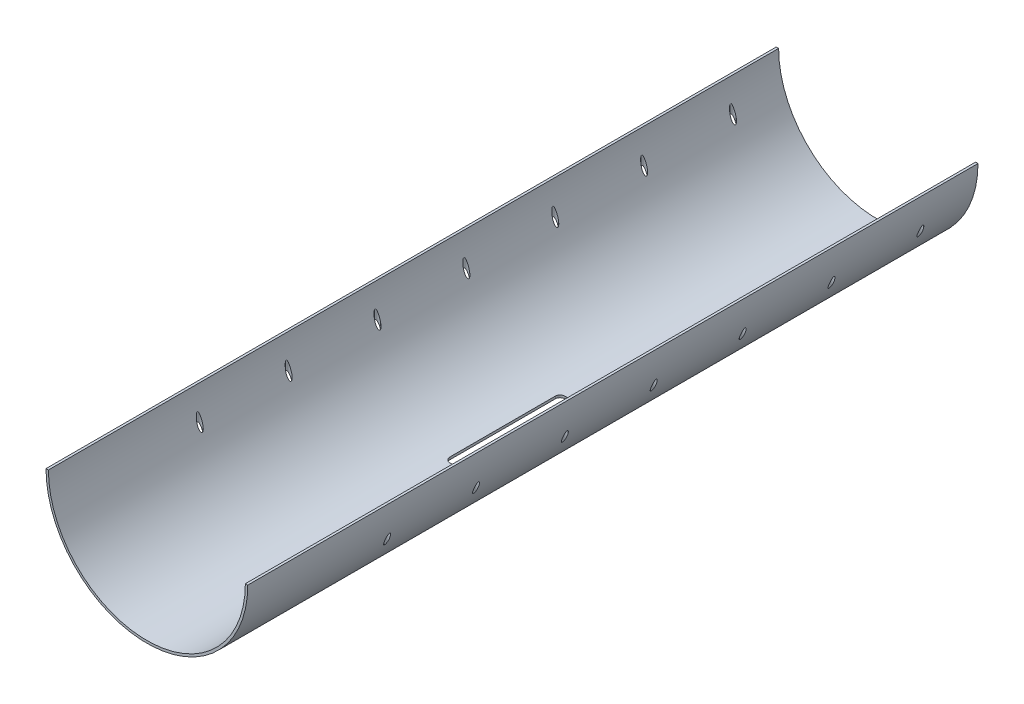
SolidWorks part; units mm, degrees
ref_plane "Plane1" through (0, 0, 0) normal (0, 0, 1) x (1, 0, 0)
ref_plane "Plane2" through (0, 0, 0) normal (0, 1, 0) x (1, 0, 0)
ref_plane "Plane3" through (0, 0, 0) normal (1, 0, 0) x (0, 0, -1)
sketch "Sketch1" plane through (0, 0, 0) normal (0, 0, 1) x (1, 0, 0)
  line L0 (-266.7, 0) -> (-260.35, 0)
  line L1 (260.35, 0) -> (266.7, 0)
  arc A0 (-260.35, 0) -> (260.35, 0) centre (0, 0) ccw
  arc A1 (-266.7, 0) -> (266.7, 0) centre (0, 0) ccw
  dimension "D1" = 520.7
  dimension "D2" = 533.4
extrude "Base-Extrude" add sketch "Sketch1" along normal blind 1930.4
sketch "Sketch2" plane through (0, 0, 0) normal (0, 1, 0) x (1, 0, 0)
  line L0 (0, 138.1703) -> (0, -2023.3965) construction
  line L2 (-6.35, -1123.2467) -> (6.35, -1123.2467)
  line L3 (-19.05, -1110.5467) -> (-19.05, -831.1467)
  line L4 (-6.35, -818.4467) -> (6.35, -818.4467)
  line L5 (19.05, -1110.5467) -> (19.05, -831.1467)
  line L6 (-19.05, -1123.2467) -> (19.05, -818.4467) construction
  line L7 (-19.05, -818.4467) -> (19.05, -1123.2467) construction
  arc A0 (6.35, -818.4467) -> (19.05, -831.1467) centre (6.35, -831.1467) cw
  arc A1 (-19.05, -831.1467) -> (-6.35, -818.4467) centre (-6.35, -831.1467) cw
  arc A2 (6.35, -1123.2467) -> (19.05, -1110.5467) centre (6.35, -1110.5467) ccw
  arc A3 (-6.35, -1123.2467) -> (-19.05, -1110.5467) centre (-6.35, -1110.5467) cw
  point P3 (0, -970.8467)
  dimension "D3" = 12.7
  dimension "D1" = 38.1
  dimension "D2" = 304.8
extrude "Cut-Extrude1" cut sketch "Sketch2" against normal through all
sketch "Sketch3" plane through (0, 0, 0) normal (0, 1, 0) x (1, 0, 0)
  circle A23 centre (-247.5629, -133.35) radius 6.5532
  circle A24 centre (-247.5629, -133.35) radius 6.5532
  circle A26 centre (-247.5629, -368.3) radius 6.5532
  circle A27 centre (-247.5629, -368.3) radius 6.5532
  circle A29 centre (-247.5629, -603.25) radius 6.5532
  circle A30 centre (-247.5629, -603.25) radius 6.5532
  circle A32 centre (-247.5629, -838.2) radius 6.5532
  circle A33 centre (-247.5629, -838.2) radius 6.5532
  circle A35 centre (-247.5629, -1073.15) radius 6.5532
  circle A36 centre (-247.5629, -1073.15) radius 6.5532
  circle A38 centre (-247.5629, -1308.1) radius 6.5532
  circle A39 centre (-247.5629, -1308.1) radius 6.5532
  circle A41 centre (-247.5629, -1543.05) radius 6.5532
  circle A42 centre (-247.5629, -1543.05) radius 6.5532
  dimension "D1" = 3.175
  dimension "D2" = 3.175
  dimension "D3" = 3.175
  dimension "D4" = 3.175
  dimension "D5" = 3.175
  dimension "D6" = 3.175
  dimension "D7" = 3.175
extrude "Cut-Extrude2" cut sketch "Sketch3" against normal through all
mirror "Mirror1" about plane through (0, 0, 0) normal (1, 0, 0) of "Cut-Extrude2"
